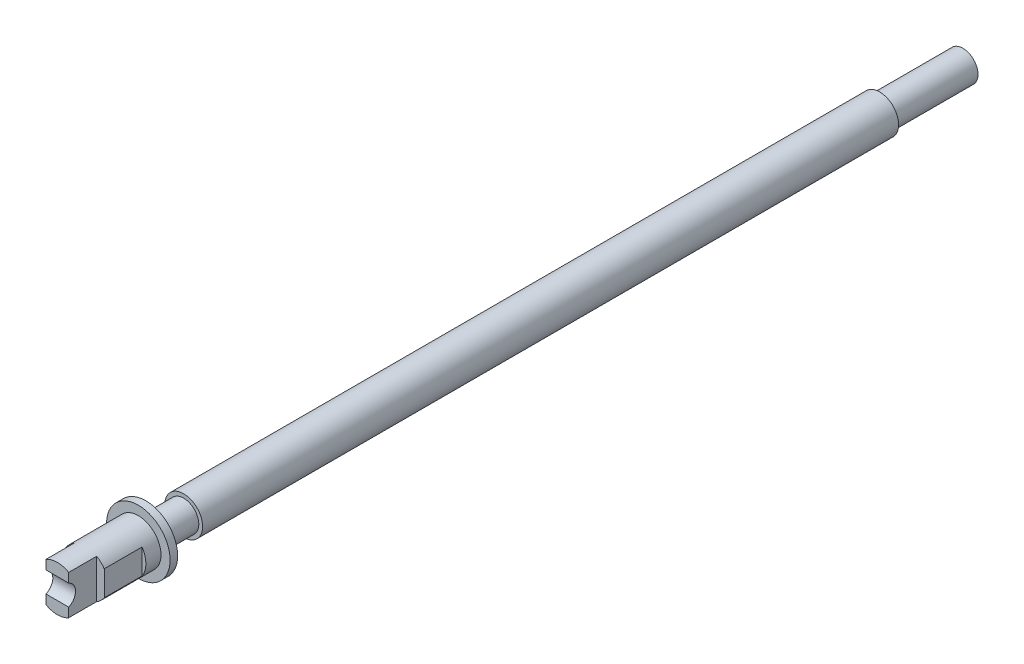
SolidWorks part; units mm, degrees
ref_plane "前视基准面" through (0, 0, 0) normal (0, 0, 1) x (1, 0, 0)
ref_plane "上视基准面" through (0, 0, 0) normal (0, 1, 0) x (1, 0, 0)
ref_plane "右视基准面" through (0, 0, 0) normal (1, 0, 0) x (0, 0, -1)
sketch "草图1" plane through (0, 0, 0) normal (0, 0, 1) x (1, 0, 0)
  circle A0 centre (0, 0) radius 1.8
extrude "凸台-拉伸1" add sketch "草图1" along normal blind 5
sketch "草图2" plane through (0, 0, 5) normal (0, 0, 1) x (1, 0, 0)
  circle A0 centre (0, 0) radius 2
extrude "凸台-拉伸2" add sketch "草图2" along normal blind 30
sketch "草图3" plane through (0, 0, 35) normal (0, 0, 1) x (1, 0, 0)
  circle A0 centre (0, 0) radius 2.5
extrude "凸台-拉伸3" add sketch "草图3" along normal blind 92
sketch "草图4" plane through (0, 0, 127) normal (0, 0, 1) x (1, 0, 0)
  circle A0 centre (0, 0) radius 2
extrude "凸台-拉伸4" add sketch "草图4" along normal blind 5
sketch "草图5" plane through (0, 0, 132) normal (0, 0, 1) x (1, 0, 0)
  circle A0 centre (0, 0) radius 4.2
extrude "凸台-拉伸5" add sketch "草图5" along normal blind 1
sketch "草图6" plane through (0, 0, 133) normal (0, 0, 1) x (1, 0, 0)
  circle A0 centre (0, 0) radius 3
extrude "凸台-拉伸6" add sketch "草图6" along normal blind 10.7
sketch "草图7" plane through (0, 0, 143.7) normal (0, 0, 1) x (1, 0, 0)
  line L0 (-3, 0) -> (2.5, 0)
  line L1 (2.5, 0) -> (2.5, 2.2912)
  line L2 (2.5, 2.2912) -> (2.5, -2.4253)
  circle A1 centre (0, 0) radius 3 construction
  circle A2 centre (0, 0) radius 3 construction
  circle A3 centre (0, 0) radius 3
extrude "切除-拉伸1" cut sketch "草图7" against normal offset from surface (8.7 mm away) 2 contours L1 L2 M1
sketch "草图8" plane through (0, 0, 143.7) normal (0, 0, 1) x (1, 0, 0)
  line L1 (-1.5, 3.755) -> (1.5, 3.755)
  line L2 (-1.5, 3.755) -> (-1.5, -3.755)
  line L3 (-1.5, -3.755) -> (1.5, -3.755)
  line L4 (1.5, 3.755) -> (1.5, -3.755)
  line L5 (-1.5, 3.755) -> (1.5, -3.755) construction
  line L6 (-1.5, -3.755) -> (1.5, 3.755) construction
  arc A0 (2.5, 1.6583) -> (2.5, -1.6583) centre (0, 0) ccw construction
  arc A1 (2.5, 1.6583) -> (2.5, -1.6583) centre (0, 0) ccw
  arc A2 (2.5, -1.6583) -> (2.5, 1.6583) centre (0, 0) ccw construction
  arc A3 (2.5, -1.6583) -> (2.5, 1.6583) centre (0, 0) ccw
  point P0 (0, 0)
extrude "切除-拉伸2" cut sketch "草图8" against normal blind 3.7 contours L2 M1 | L4 M1 M2
sketch "草图9" plane through (0, 0, 0) normal (0, 0, -1) x (-1, 0, 0)
  circle A0 centre (0, 0) radius 3.8676
extrude "切除-拉伸3" cut sketch "草图9" against normal blind 24
sketch "草图10" plane through (2.5, 0, 0) normal (1, 0, 0) x (0, 0, -1)
  line L0 (-142.6, 0) -> (-146, 0)
  line L3 (-146, 0) -> (-142.6, 0)
  circle A0 centre (-144.3, 0) radius 1.5
extrude "切除-拉伸4" cut sketch "草图10" against normal blind 10 contours L3 A0 | L3 A0
